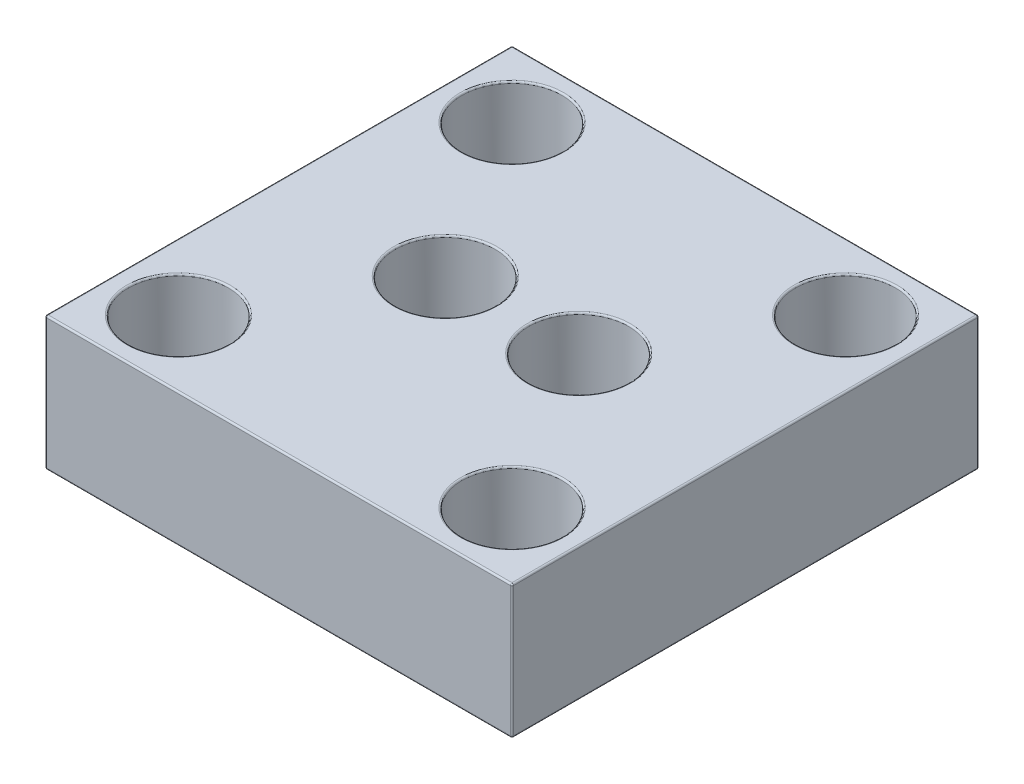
SolidWorks part; units mm, degrees
ref_plane "Front Plane" through (0, 0, 0) normal (0, 0, 1) x (1, 0, 0)
ref_plane "Top Plane" through (0, 0, 0) normal (0, 1, 0) x (1, 0, 0)
ref_plane "Right Plane" through (0, 0, 0) normal (1, 0, 0) x (0, 0, -1)
sketch "Sketch1" plane through (0, 0, 0) normal (0, 1, 0) x (1, 0, 0)
  line L1 (0, 0) -> (70, 0)
  line L2 (0, 0) -> (0, 70)
  line L3 (0, 70) -> (70, 70)
  line L4 (70, 0) -> (70, 70)
  dimension "D1" = 70
  dimension "D2" = 70
extrude "Boss-Extrude1" add sketch "Sketch1" along normal blind 20
sketch "Sketch2" plane through (0, 20, 0) normal (0, 1, 0) x (1, 0, 0)
  line L0 (35, 70) -> (35, 0) construction
  line L3 (70, 70) -> (0, 70) construction
  line L4 (0, 0) -> (70, 0) construction
  line L5 (70, 35) -> (0, 35) construction
  line L6 (70, 0) -> (70, 70) construction
  line L7 (0, 70) -> (0, 0) construction
  circle A0 centre (10, 60) radius 4.5
  circle A1 centre (25, 35) radius 4.5
  circle A2 centre (10, 10) radius 4.5
  circle A3 centre (60, 10) radius 4.5
  circle A4 centre (45, 35) radius 4.5
  circle A5 centre (60, 60) radius 4.5
  dimension "D1" = 25
  dimension "D2" = 25
  dimension "D3" = 50
  dimension "D4" = 25
  dimension "D5" = 9
  dimension "D6" = 9
  dimension "D7" = 9
  dimension "D8" = 10
  dimension "D9" = 25
extrude "Cut-Extrude1" cut sketch "Sketch2" against normal through all
sketch "Sketch3" plane through (0, 20, 0) normal (0, 1, 0) x (1, 0, 0)
  circle A0 centre (10, 60) radius 7.5
  circle A1 centre (25, 35) radius 7.5
  circle A2 centre (10, 10) radius 7.5
  circle A3 centre (45, 35) radius 7.5
  circle A4 centre (60, 60) radius 7.5
  circle A5 centre (60, 10) radius 7.5
  dimension "D1" = 15
  dimension "D2" = 15
  dimension "D3" = 15
  dimension "D4" = 15
  dimension "D5" = 15
  dimension "D6" = 15
extrude "Cut-Extrude2" cut sketch "Sketch3" against normal blind 12
fillet "Fillet1" radius 0.25 24 edges at (10, 0, -55.5) (25, 0, -30.5) (10, 0, -5.5) (60, 0, -14.5) (45, 0, -39.5) (60, 0, -64.5) (0, 0, -35) (0, 10, -70) (35, 0, -70) (70, 10, -70) (70, 0, -35) (0, 10, 0) (70, 10, 0) (35, 0, 0) (35, 20, -70) (70, 20, -35) (35, 20, 0) (0, 20, -35) (10, 20, -52.5) (25, 20, -27.5) (10, 20, -2.5) (45, 20, -27.5) (60, 20, -52.5) (60, 20, -2.5)
